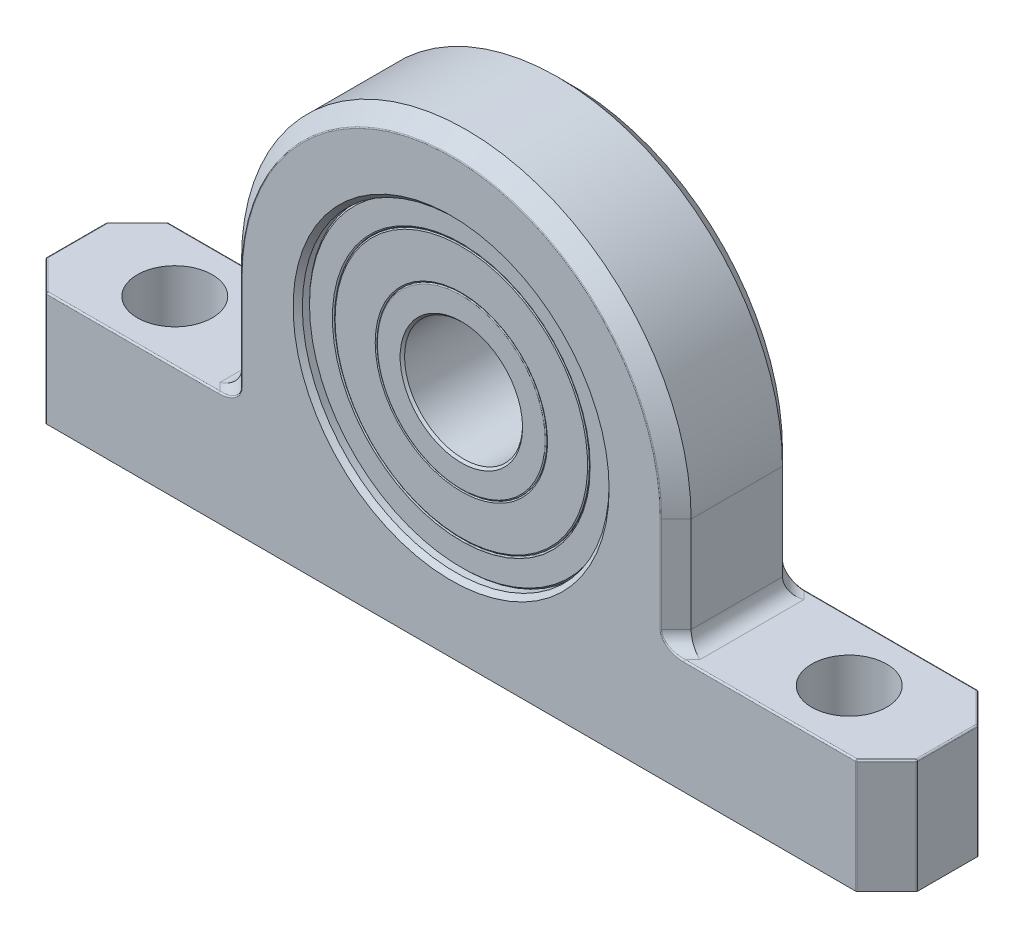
SolidWorks part; units mm, degrees
ref_plane "Front Plane" through (0, 0, 0) normal (0, 0, 1) x (1, 0, 0)
ref_plane "Top Plane" through (0, 0, 0) normal (0, 1, 0) x (1, 0, 0)
ref_plane "Right Plane" through (0, 0, 0) normal (1, 0, 0) x (0, 0, -1)
sketch "Sketch1" plane through (0, 0, 0) normal (0, 0, 1) x (1, 0, 0)
  line L0 (9.525, 0) -> (9.525, -4.699)
  line L1 (9.525, -4.699) -> (18.4547, -4.699)
  line L2 (18.4547, -4.699) -> (18.4547, -9.525)
  line L3 (18.4547, -9.525) -> (-18.4547, -9.525)
  line L4 (-18.4547, -9.525) -> (-18.4547, -4.699)
  line L5 (-18.4547, -4.699) -> (-9.525, -4.699)
  line L6 (-9.525, -4.699) -> (-9.525, 0)
  circle A0 centre (0, 0) radius 2.5
  arc A1 (9.525, 0) -> (-9.525, 0) centre (0, 0) ccw
  circle A2 centre (0, 0) radius 6.5
  point P12 (0, 6.5)
  point P13 (0, 2.5)
sketch "Sketch2" plane through (0, 0, 0) normal (0, 1, 0) x (1, 0, 0)
  line L0 (0, 2.5797) -> (0, -2.5797) construction
  line L1 (-14.2875, 0) -> (14.2875, 0) construction
  circle A0 centre (14.2875, 0) radius 1.5875 construction
  circle A1 centre (-14.2875, 0) radius 1.5875 construction
sketch "Sketch3" plane through (0, 0, 0) normal (0, 0, 1) x (1, 0, 0)
  line L0 (9.525, 0) -> (9.525, -4.699) construction
  line L1 (18.4547, -4.699) -> (18.4547, -9.525) construction
  line L2 (9.525, -4.699) -> (18.4547, -4.699) construction
  line L3 (18.4547, -9.525) -> (-18.4547, -9.525) construction
  line L4 (-18.4547, -9.525) -> (-18.4547, -4.699) construction
  line L5 (-18.4547, -4.699) -> (-9.525, -4.699) construction
  line L6 (-9.525, -4.699) -> (-9.525, 0) construction
  line L7 (9.525, 0) -> (9.525, -4.699)
  line L8 (18.4547, -4.699) -> (18.4547, -9.525)
  line L9 (9.525, -4.699) -> (18.4547, -4.699)
  line L10 (18.4547, -9.525) -> (-18.4547, -9.525)
  line L11 (-18.4547, -9.525) -> (-18.4547, -4.699)
  line L12 (-18.4547, -4.699) -> (-9.525, -4.699)
  line L13 (-9.525, -4.699) -> (-9.525, 0)
  arc A0 (9.525, 0) -> (-9.525, 0) centre (0, 0) ccw construction
  circle A1 centre (0, 0) radius 6.5 construction
  arc A2 (9.525, 0) -> (-9.525, 0) centre (0, 0) ccw
  circle A3 centre (0, 0) radius 6.5
extrude "Extrude1" add sketch "Sketch3" along normal up to vertex and the other way up to vertex
sketch "Sketch4" plane through (0, -4.699, 0) normal (0, 1, 0) x (1, 0, 0)
  line L0 (-18.4547, 2.5797) -> (-18.4547, 1.2898)
  line L1 (-18.4547, -2.5797) -> (-18.4547, 2.5797) construction
  line L2 (-18.4547, 1.2898) -> (-17.1648, 2.5797)
  line L3 (-9.525, 2.5797) -> (-18.4547, 2.5797) construction
  line L4 (-17.1648, 2.5797) -> (-18.4547, 2.5797)
  line L5 (0, 0) -> (0, 2.5797) construction
  line L6 (0, 0) -> (-14.2875, 0) construction
  line L7 (17.1648, 2.5797) -> (18.4547, 2.5797)
  line L8 (18.4547, 1.2898) -> (17.1648, 2.5797)
  line L9 (18.4547, 2.5797) -> (18.4547, 1.2898)
  line L10 (18.4547, -2.5797) -> (18.4547, -1.2898)
  line L11 (18.4547, -1.2898) -> (17.1648, -2.5797)
  line L12 (17.1648, -2.5797) -> (18.4547, -2.5797)
  line L13 (-17.1648, -2.5797) -> (-18.4547, -2.5797)
  line L14 (-18.4547, -1.2898) -> (-17.1648, -2.5797)
  line L15 (-18.4547, -2.5797) -> (-18.4547, -1.2898)
  circle A0 centre (-14.2875, 0) radius 1.5875 construction
  circle A1 centre (14.2875, 0) radius 1.5875 construction
  circle A2 centre (-14.2875, 0) radius 1.5875
  circle A3 centre (14.2875, 0) radius 1.5875
extrude "Cut-Extrude1" cut sketch "Sketch4" against normal through all
chamfer "Chamfer3" distance 0.6449 angle 45 6 edges at (-9.525, -2.3495, -2.5797) (0, 9.525, -2.5797) (9.525, -2.3495, -2.5797) (-9.525, -2.3495, 2.5797) (0, 9.525, 2.5797) (9.525, -2.3495, 2.5797)
fillet "Fillet6" radius 0.6449 6 edges at (9.525, -4.699, 0) (9.2025, -4.699, -2.2572) (9.2025, -4.699, 2.2572) (-9.2025, -4.699, -2.2572) (-9.2025, -4.699, 2.2572) (-9.525, -4.699, 0)
fillet "Fillet7" radius 0.0645 28 edges at (13.4785, -4.699, -2.5797) (9.1472, -4.5101, -2.5797) (8.8801, -2.027, -2.5797) (0, 8.8801, -2.5797) (-8.8801, -2.027, -2.5797) (-9.1472, -4.5101, -2.5797) (13.4785, -4.699, 2.5797) (9.1472, -4.5101, 2.5797) (8.8801, -2.027, 2.5797) (0, 8.8801, 2.5797) (-8.8801, -2.027, 2.5797) (-9.1472, -4.5101, 2.5797) (17.8098, -4.699, 1.9348) (18.4547, -4.699, 0) (17.8098, -4.699, -1.9348) (-13.4785, -4.699, -2.5797) (-17.8098, -4.699, -1.9348) (-18.4547, -4.699, 0) (-17.8098, -4.699, 1.9348) (-13.4785, -4.699, 2.5797) (-18.4547, -7.112, -1.2898) (-17.1648, -7.112, -2.5797) (-18.4547, -7.112, 1.2898) (-17.1648, -7.112, 2.5797) (17.1648, -7.112, -2.5797) (18.4547, -7.112, -1.2898) (18.4547, -7.112, 1.2898) (17.1648, -7.112, 2.5797)
chamfer "Chamfer4" distance 0.195 angle 45 2 edges at (6.5, 0, -2.5797) (6.5, 0, 2.5797)
sketch "Sketch5" plane through (0, 0, 0) normal (1, 0, 0) x (0, 0, -1)
  line L2 (2.1462, 6.5) -> (2.1462, 5.4)
  line L4 (2.1462, 5.4) -> (-2.1462, 5.4)
  line L8 (-2.1462, 2.5) -> (2.1462, 2.5)
  line L9 (2.1462, 3.6) -> (-2.1462, 3.6)
  line L10 (-2.1462, 6.5) -> (2.1462, 6.5)
  line L12 (-2.1462, 3.6) -> (-2.1462, 2.5)
  line L13 (-2.1462, 6.5) -> (-2.1462, 5.4)
  line L17 (0, 6.5) -> (0, 9.525) construction
  line L18 (0, 9.525) -> (0, 0) construction
  line L24 (2.1462, 3.6) -> (2.1462, 2.5)
  line L27 (1.9348, 9.525) -> (-1.9348, 9.525) construction
revolve "Revolve1" add sketch "Sketch5" angle 360 about L0
sketch "Sketch6" plane through (0, 0, 0) normal (1, 0, 0) x (0, 0, -1)
  line L9 (2.1462, 3.6) -> (-2.1462, 3.6) construction
  line L10 (0, 0) -> (0, 2.6695) construction
  line L19 (0, 0) -> (1.2184, 0) construction
  line L21 (-2.1462, 5.4) -> (-1.6097, 5.4)
  line L23 (-2.1462, 5.4) -> (-2.1462, 3.6)
  line L24 (-2.1462, 3.6) -> (-1.6097, 3.6)
  line L25 (-1.6097, 5.4) -> (-1.6097, 3.6)
  line L27 (2.1462, 5.4) -> (1.6097, 5.4)
  line L28 (2.1462, 5.4) -> (2.1462, 3.6)
  line L29 (2.1462, 3.6) -> (1.6097, 3.6)
  line L30 (1.6097, 5.4) -> (1.6097, 3.6)
revolve "Revolve2" add sketch "Sketch6" angle 360 about L19
chamfer "Chamfer5" distance 0.0937 angle 45 2 edges at (-2.5, 0, 2.1462) (-2.5, 0, -2.1462)
fillet "Fillet8" radius 0.05 2 edges at (-3.6, 0, -2.1462) (-3.6, 0, 2.1462)
fillet "Fillet9" radius 0.065 2 edges at (-5.4, 0, -2.1462) (-5.4, 0, 2.1462)
chamfer "Chamfer6" distance 0.065 angle 45 2 edges at (-6.5, 0, -2.1462) (-6.5, 0, 2.1462)
chamfer "Chamfer7" distance 0.05 angle 30 2 edges at (5.4, 0, 2.1462) (3.6, 0, 2.1462)
chamfer "Chamfer8" distance 0.05 angle 30 2 edges at (5.4, 0, -2.1462) (3.6, 0, -2.1462)
equation "\"D2@Sketch4\" = \"Overall Width@Sketch2\" / 4"
equation "\"D1@Chamfer3\"=\"Overall Width@Sketch2\" / 8"
equation "\"D1@Fillet6\"=\"D1@Chamfer3\""
equation "\"D3@Sketch5\"=(\"Overall Width@Sketch2\"-2*\"D1@Chamfer4\")*.9"
equation "\"D1@Chamfer5\"=\"ID@Sketch1\"*.01875"
equation "\"D1@Fillet8\"=\"ID@Sketch1\"*.01"
equation "\"D1@Fillet9\"=\"Bearing OD@Sketch1\"*.005"
equation "\"D1@Chamfer6\"=\"Bearing OD@Sketch1\"*.005"
equation "\"D1@Chamfer4\"=\"Bearing OD@Sketch1\"*.015"
equation "\"D1@Fillet7\"=\"Overall Width@Sketch2\"*.0125"
equation "\"D2@Sketch5\"=(\"Bearing OD@Sketch1\"-\"ID@Sketch1\")/2*.45"
equation "\"D1@Sketch6\"=\"D3@Sketch5\"/8"
equation "\"D1@Chamfer7\"=\"ID@Sketch1\"*.01"
equation "\"D1@Chamfer8\"=\"ID@Sketch1\"*.01"
